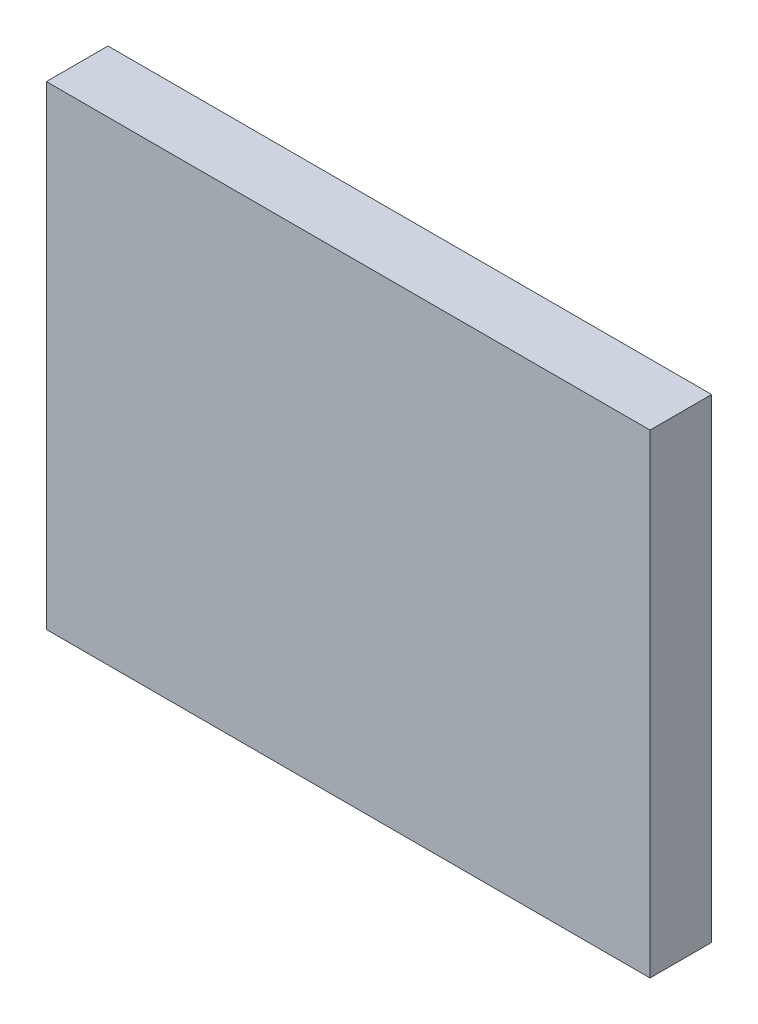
SolidWorks part; units mm, degrees
ref_plane "Alzado" through (0, 0, 0) normal (0, 0, 1) x (1, 0, 0)
ref_plane "Planta" through (0, 0, 0) normal (0, 1, 0) x (1, 0, 0)
ref_plane "Vista lateral" through (0, 0, 0) normal (1, 0, 0) x (0, 0, -1)
sketch "Croquis1" plane through (0, 0, 0) normal (0, 0, 1) x (1, 0, 0)
  line L1 (-45.3927, 32.4481) -> (52.583, 32.4481)
  line L2 (-45.3927, 32.4481) -> (-45.3927, -44.5688)
  line L3 (-45.3927, -44.5688) -> (52.583, -44.5688)
  line L4 (52.583, 32.4481) -> (52.583, -44.5688)
extrude "Saliente-Extruir1" add sketch "Croquis1" along normal blind 10 contours L4 L1 L2 L3
